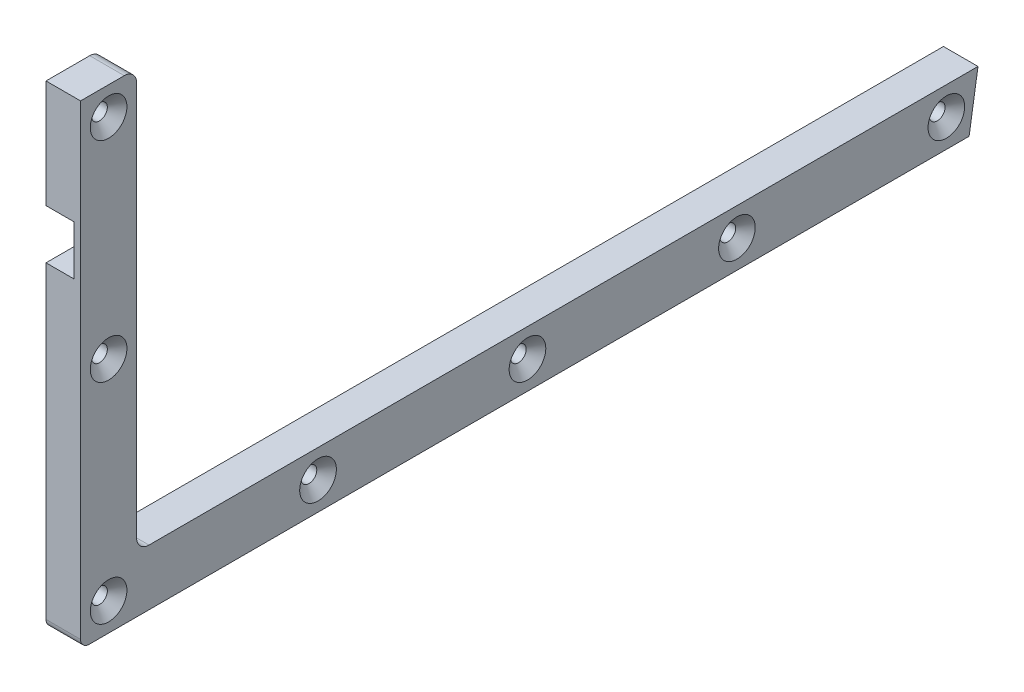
SolidWorks part; units mm, degrees
ref_plane "Front Plane" through (0, 0, 0) normal (0, 0, 1) x (1, 0, 0)
ref_plane "Top Plane" through (0, 0, 0) normal (0, 1, 0) x (1, 0, 0)
ref_plane "Right Plane" through (0, 0, 0) normal (1, 0, 0) x (0, 0, -1)
sketch "Sketch1" plane through (0, 0, 0) normal (1, 0, 0) x (0, 0, -1)
  line L0 (-7.519, 58.7456) -> (-7.519, -54.3707)
  line L1 (-5.4354, -56.4544) -> (208, -56.4544)
  line L2 (208, -56.4544) -> (210.155, -42.8544)
  line L3 (210.155, -42.8544) -> (9.081, -42.8544)
  line L4 (6.081, -39.8544) -> (6.081, 55.7456)
  line L5 (3.081, 58.7456) -> (-7.519, 58.7456)
  line L6 (-7.519, 108.6456) -> (-7.519, -56.4544) construction
  line L7 (-7.519, -56.4544) -> (208, -56.4544) construction
  line L11 (11.281, 58.7456) -> (-7.519, 58.7456) construction
  line L14 (208, -56.4544) -> (221.081, 26.0956) construction
  line L15 (50.081, -42.8544) -> (50.081, -56.4544) construction
  line L16 (6.081, 51.9456) -> (-7.519, 51.9456) construction
  line L17 (-0.719, -49.6544) -> (50.081, -49.6544) construction
  line L18 (50.081, -49.6544) -> (100.881, -49.6544) construction
  line L19 (100.881, -49.6544) -> (151.681, -49.6544) construction
  line L20 (151.681, -49.6544) -> (202.481, -49.6544) construction
  circle A0 centre (100.881, -49.6544) radius 1.905
  arc A2 (9.081, -42.8544) -> (6.081, -39.8544) centre (9.081, -39.8544) cw
  arc A4 (6.081, 55.7456) -> (3.081, 58.7456) centre (3.081, 55.7456) ccw
  arc A6 (-7.519, -54.3707) -> (-5.4354, -56.4544) centre (-5.4354, -54.3707) ccw
  arc A7 (60.081, -42.6544) -> (57.081, -39.6544) centre (57.081, -42.6544) ccw construction
  circle A9 centre (151.681, -49.6544) radius 1.905
  circle A10 centre (50.081, -49.6544) radius 1.905
  circle A11 centre (-0.719, -49.6544) radius 1.905
  circle A12 centre (-0.719, 1.1456) radius 1.905
  circle A13 centre (-0.719, 51.9456) radius 1.905
  circle A14 centre (202.481, -49.6544) radius 1.905
  point P8 (50.081, -49.6544)
  point P21 (-0.719, 51.9456)
  point P43 (-5.4354, -54.3707)
  dimension "D2" = 3.81
extrude "Boss-Extrude1" add sketch "Sketch1" along normal blind 8.382
chamfer "Chamfer1" distance 2.54 angle 41 7 edges at (8.382, -49.6544, -51.986) (8.382, -49.6544, -1.186) (8.382, 1.1456, -1.186) (8.382, 51.9456, -1.186) (8.382, -49.6544, -204.386) (8.382, -49.6544, -153.586) (8.382, -49.6544, -102.786)
sketch "Sketch2" plane through (0, 0, 0) normal (-1, 0, 0) x (0, 0, 1)
  line L0 (7.519, 58.7456) -> (7.519, -54.3707) construction
  line L1 (7.519, 32.5456) -> (-11.281, 32.5456)
  line L2 (7.519, 32.5456) -> (7.519, 20.5456)
  line L3 (7.519, 20.5456) -> (-11.281, 20.5456)
  line L4 (-11.281, 32.5456) -> (-11.281, 20.5456)
  line L5 (-11.281, 31.5456) -> (7.519, 31.5456) construction
  line L6 (7.519, 21.5456) -> (-11.281, 21.5456) construction
  line L7 (-11.281, 21.5456) -> (-11.281, 31.5456) construction
  dimension "D1" = 1
  dimension "D2" = 1
extrude "Cut-Extrude1" cut sketch "Sketch2" against normal offset from surface (6.782 mm away) 1.6
